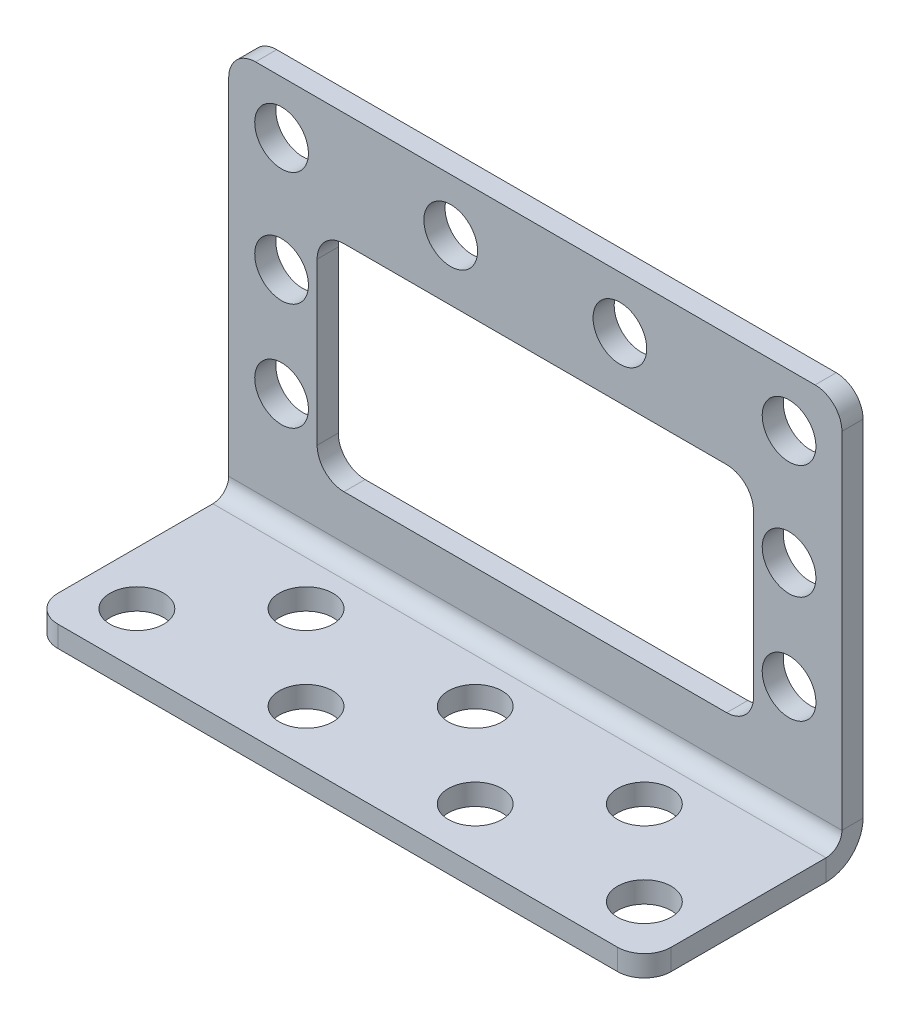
SolidWorks part; units mm, degrees
ref_plane "Front Plane" through (0, 0, 0) normal (0, 0, 1) x (1, 0, 0)
ref_plane "Top Plane" through (0, 0, 0) normal (0, 1, 0) x (1, 0, 0)
ref_plane "Right Plane" through (0, 0, 0) normal (1, 0, 0) x (0, 0, -1)
sketch "Sketch1" plane through (0, 0, 0) normal (0, 1, 0) x (1, 0, 0)
  line L0 (-24, 5.08) -> (-24, -5.08) construction
  line L1 (-24, -5.08) -> (-24, 0) construction
  line L2 (-26.46, -35.46) -> (26.46, -35.46)
  line L3 (-18.0975, -10.16) -> (18.0975, -10.16)
  line L4 (24, 0) -> (10.03, 0) construction
  line L5 (-24, 15.8707) -> (-24, -30.46) construction
  line L6 (-24, 0) -> (-10.03, 0) construction
  line L7 (24, 5.08) -> (24, -5.08) construction
  line L8 (-29, 18.3307) -> (-29, -32.92)
  line L9 (31.3596, -22.46) -> (-39.7694, -22.46) construction
  line L10 (29, 18.3307) -> (29, -32.92)
  line L11 (24, 15.8707) -> (24, -30.46) construction
  line L12 (-20.6375, -7.62) -> (-20.6375, 7.62)
  line L14 (31.3596, -30.46) -> (-41.4431, -30.46) construction
  line L15 (34.1787, 15.8707) -> (-42.5535, 15.8707) construction
  line L16 (20.6375, -7.62) -> (20.6375, 7.62)
  line L17 (-8, 15.8707) -> (-8, -30.46) construction
  line L19 (8, 15.8707) -> (8, -30.46) construction
  line L21 (-18.0975, 10.16) -> (18.0975, 10.16)
  line L22 (-26.46, 20.8707) -> (26.46, 20.8707)
  arc A0 (29, -32.92) -> (26.46, -35.46) centre (26.46, -32.92) cw
  arc A1 (-20.6375, 7.62) -> (-18.0975, 10.16) centre (-18.0975, 7.62) cw
  arc A2 (-18.0975, -10.16) -> (-20.6375, -7.62) centre (-18.0975, -7.62) cw
  circle A3 centre (0, -22.46) radius 2.54
  circle A4 centre (-16, -22.46) radius 2.54
  circle A5 centre (10.03, 0) radius 16 construction
  circle A6 centre (-10.03, 0) radius 16 construction
  circle A7 centre (-8, -30.46) radius 2.54
  circle A8 centre (8, -30.46) radius 2.54
  arc A9 (18.0975, -10.16) -> (20.6375, -7.62) centre (18.0975, -7.62) ccw
  arc A10 (20.6375, 7.62) -> (18.0975, 10.16) centre (18.0975, 7.62) ccw
  arc A11 (29, 18.3307) -> (26.46, 20.8707) centre (26.46, 18.3307) ccw
  circle A12 centre (16, -22.46) radius 2.54
  circle A13 centre (-24, 5.08) radius 2.54
  circle A14 centre (24, 5.08) radius 2.54
  circle A15 centre (-24, -5.08) radius 2.54
  circle A16 centre (24, -5.08) radius 2.54
  circle A17 centre (24, 15.8707) radius 2.54
  circle A18 centre (-24, 15.8707) radius 2.54
  arc A19 (-29, 18.3307) -> (-26.46, 20.8707) centre (-26.46, 18.3307) cw
  arc A20 (-26.46, -35.46) -> (-29, -32.92) centre (-26.46, -32.92) cw
  circle A21 centre (-24, -30.46) radius 2.54
  circle A22 centre (24, -30.46) radius 2.54
  circle A25 centre (8, 15.8707) radius 2.54
  circle A26 centre (-8, 15.8707) radius 2.54
  dimension "D8" = 16
  dimension "D11" = 16
  dimension "D9" = 16
  dimension "D10" = 16
  dimension "D12" = 10.16
  dimension "D16" = 16
  dimension "D17" = 10.16
  dimension "D23" = 8
  dimension "D24" = 32
  dimension "D25" = 5
  dimension "D14" = 2.54
  dimension "D19" = 32
  dimension "D20" = 2.54
  dimension "D26" = 5
  dimension "D27" = 2.54
  dimension "D2" = 3.3625
  dimension "D3" = 5
  dimension "D4" = 5
  dimension "D5" = 13.97
  dimension "D6" = 12.3
  dimension "D7" = 8
  dimension "D13" = 41.275
  dimension "D15" = 13.97
  dimension "D18" = 10.16
  dimension "D21" = 8
  dimension "D22" = 20.32
sheet metal parameters "Sheet-Metal1" thickness 2 parameters "D1"=2
base flange "Base-Flange1" sketch "Sketch1" thickness 2 reverse thickness direction yes parameters "D1"=2
sketch "Sketch5" plane through (0, 2, 0) normal (0, 1, 0) x (1, 0, 0)
  line L0 (-35.4424, -16.31) -> (38.479, -16.31)
  line L2 (-18.0975, -10.16) -> (18.0975, -10.16) construction
  dimension "D1" = 6.15
sketched bend "Sketched Bend2" parameters "D1"=1.5
bend "SketchBend1" bend radius 1.5 bend angle 90 parameters "D5"=1
ref_point "Point1"
ref_plane "Plane1" through (0, 0, 30.46) normal (0, 0, 1) x (1, 0, 0)
flat pattern "Flat-Pattern1"
sketch "Bend-Lines1" plane through (0, 0, 16.7735) normal (0, 0, 1) x (1, 0, 0)
  line L0 (-29, 1.5365) -> (29, 1.5365) construction
  line L1 (-29, 1.5365) -> (29, 1.5365) construction
bend of the flat pattern "Flatten-<SketchBend1>1"
